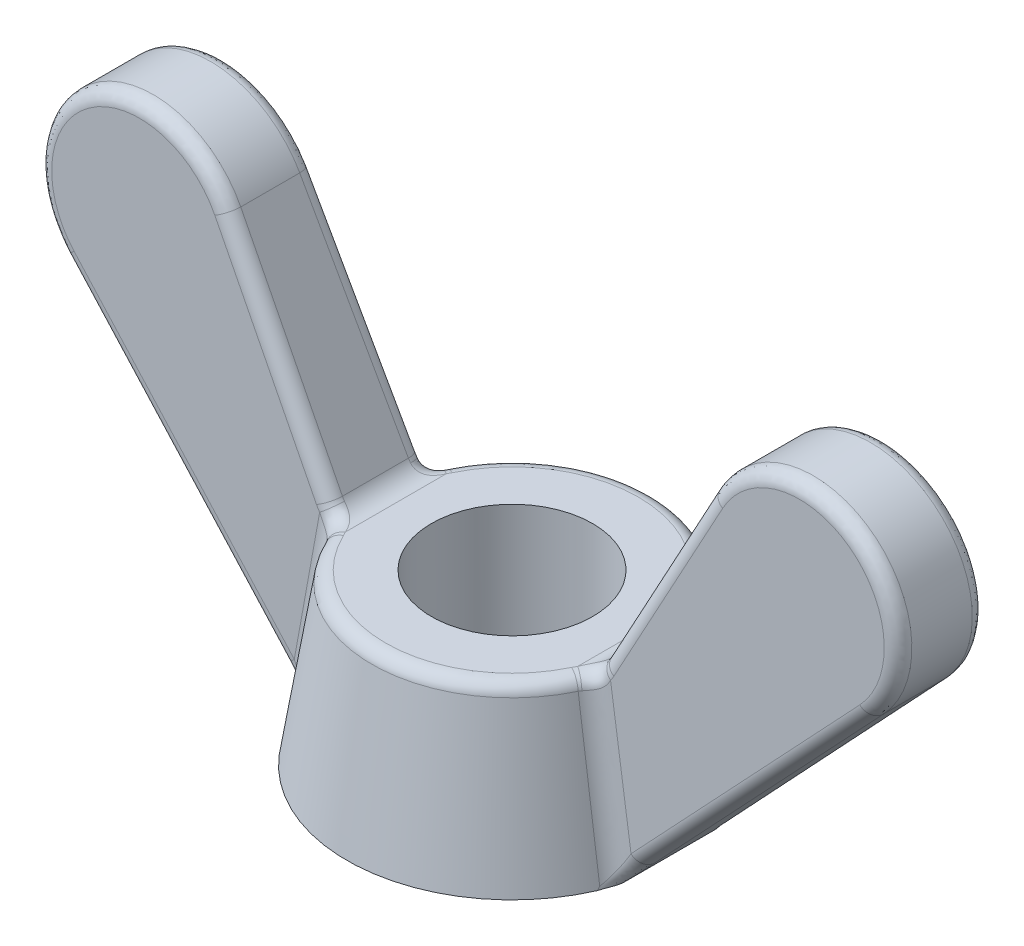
SolidWorks part; units mm, degrees
ref_plane "Front Plane" through (0, 0, 0) normal (0, 0, 1) x (1, 0, 0)
ref_plane "Top Plane" through (0, 0, 0) normal (0, 1, 0) x (1, 0, 0)
ref_plane "Right Plane" through (0, 0, 0) normal (1, 0, 0) x (0, 0, -1)
other "Configuration Table"
sketch "BaseNutSke" plane through (0, 0, 0) normal (0, 0, 1) x (1, 0, 0)
  line L0 (0, 0) -> (-21.5, 0)
  line L1 (-21.5, 0) -> (-18, 22)
  line L2 (-18, 22) -> (0, 22)
  line L3 (0, 22) -> (0, 0)
  line L4 (0, -38.5148) -> (0, 38.5148) construction
revolve "BaseNut" add sketch "BaseNutSke" angle 360 about L4
sketch "BaseWingSke" plane through (0, 0, 0) normal (1, 0, 0) x (0, 0, -1)
  line L0 (0, 0) -> (0, 62.8635) construction
  line L1 (-5.5, 56) -> (-6.5, 0)
  line L2 (-5.5, 56) -> (5.5, 56)
  line L3 (5.5, 56) -> (6.5, 0)
  line L4 (6.5, 0) -> (-6.5, 0)
  point P8 (0, 56)
  dimension "TopWing_Width" = 11
  dimension "BottomWing_Width" = 13
  dimension "Height" = 56
extrude "BaseWing" add sketch "BaseWingSke" along normal mid plane 112
sketch "CutWingSke" plane through (0, 0, 0) normal (0, 0, 1) x (1, 0, 0)
  line L0 (0, 0) -> (0, 84.5075) construction
  line L1 (-20.4939, 0) -> (-52.4668, 34.043)
  line L2 (-16.9323, 22) -> (-31.4795, 49.126)
  line L3 (56, 56) -> (-56, 56) construction
  line L4 (-56, 56) -> (-56, 0) construction
  line L5 (-16.9323, 22) -> (16.9323, 22)
  line L6 (-20.4939, 0) -> (20.4939, 0)
  line L7 (20.4939, 0) -> (52.4668, 34.043)
  line L8 (16.9323, 22) -> (31.4795, 49.126)
  line L9 (-20.4939, 0) -> (-56, 0) construction
  line L10 (-66, 66) -> (66, 66)
  line L11 (-66, 66) -> (-66, -10)
  line L12 (-66, -10) -> (66, -10)
  line L13 (66, 66) -> (66, -10)
  line L14 (56, 56) -> (56, 0) construction
  arc A0 (-31.4795, 49.126) -> (-52.4668, 34.043) centre (-42.966, 42.966) ccw
  arc A1 (31.4795, 49.126) -> (52.4668, 34.043) centre (42.966, 42.966) cw
  dimension "D1" = 10
  dimension "Wing_ang" = 15
  dimension "D2" = 10
  dimension "D3" = 10
  dimension "D4" = 10
extrude "CutWing" cut sketch "CutWingSke" against normal mid plane 112
sketch "HoleSke" plane through (0, 0, 0) normal (0, 1, 0) x (1, 0, 0)
  circle A0 centre (0, 0) radius 10.5
extrude "TappedHole" cut sketch "HoleSke" along normal through all
chamfer "Chamfer1" distance 1.4 angle 60 1 edges at (0, 0, 10.5)
sketch "ThdSchSke" plane through (0, 0, 0) normal (0, 0, 1) x (1, 0, 0)
  line L0 (10.5, 1.4) -> (8.7679, 1.4)
  line L1 (8.7679, 1.4) -> (8.7679, 3.1321)
  line L2 (8.7679, 3.1321) -> (10.5, 3.1321)
  line L3 (10.5, 3.1321) -> (12, 2.266)
  line L4 (12, 2.266) -> (10.5, 1.4)
  line L5 (0, -3.4614) -> (0, 8.4929) construction
  line L6 (-10.5, 1.4) -> (10.5, 1.4) construction
revolve "ThreadSchematic" [suppressed] cut sketch "ThdSchSke" angle 360 about L5
pattern_linear "ThdSchPat" [suppressed]
fillet "Fillet1" radius 3 6 edges at (-16.9323, 22, 0) (16.9323, 22, 0)
fillet "Fillet2" radius 1.8 30 edges at (-21.4266, 0.9931, 6.6579) (-37.3823, 17.9819, 6.1789) (-50.5726, 53.5502, 5.5437) (-24.9759, 36.9987, 5.8393) (-17.1926, 22.8149, 6.5578) (0, 22, -18) (0, 22, 18) (16.7923, 22.498, 6.9107) (24.9759, 36.9987, 5.8393) (21.2732, 0.8298, 6.7311) (37.3823, 17.9819, 6.1789) (21.4266, 0.9931, -6.6579) (37.3823, 17.9819, -6.1789) (50.5726, 53.5502, -5.5437) (-21.2732, 0.8298, -6.7311) (-37.3823, 17.9819, -6.1789) (-50.5726, 53.5502, -5.5437) (-24.9759, 36.9987, -5.8393) (-16.7923, 22.498, -6.9107) (17.1926, 22.8149, -6.5578) (50.5726, 53.5502, 5.5437) (24.9759, 36.9987, -5.8393)
equation "\"D1@CutWing\" = \"Width@BaseWing\""
equation "\"D1@Chamfer1\" = \"Tap_drill@HoleSke\"/15"
equation "\"D1@ThdSchSke\" = \"Tap_drill@HoleSke\""
equation "\"ThreadN@ThdSchSke\" = \"Thread_major@ThreadCosmetic\""
equation "\"Num_threads@ThdSchPat\" = int( \"Nut_Height@BaseNutSke\"/\"Advance@ThdSchPat\" ) +1"
equation "\"D1@Fillet1\" =\"Top_Width@BaseNutSke\"/12"
equation "\"D1@Fillet2\" = \"Top_Width@BaseNutSke\"/20"
